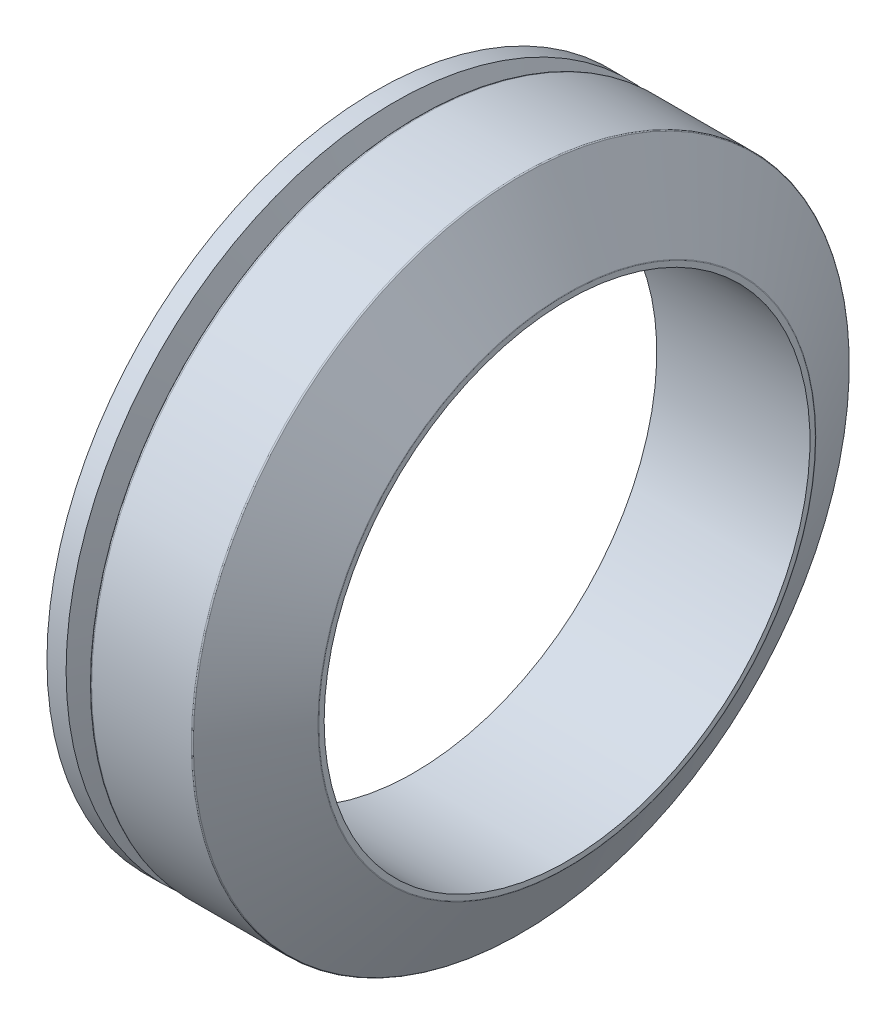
SolidWorks part; units mm, degrees
ref_plane "Plan1" through (0, 0, 0) normal (0, 0, 1) x (1, 0, 0)
ref_plane "Plan2" through (0, 0, 0) normal (0, 1, 0) x (1, 0, 0)
ref_plane "Plan3" through (0, 0, 0) normal (1, 0, 0) x (0, 0, -1)
sketch "Esquisse1" plane through (0, 0, 0) normal (0, 0, 1) x (1, 0, 0)
  line L0 (0, 0) -> (6.7, 0) construction
  line L1 (1.34, 8.5) -> (6.7, 8.5)
  line L2 (6.7, 8.5) -> (6.7, 8.6866)
  line L3 (5.0546, 11.5) -> (1.5644, 11.5)
  line L4 (1.216, 10) -> (1.4659, 11.4174)
  line L5 (1.216, 10) -> (0.67, 11.5)
  line L6 (8.5, 0) -> (-8.5, 0) construction
  line L7 (11.5, 0) -> (-11.5, 0) construction
  line L8 (0, 11.5) -> (1.34, 8.5)
  line L9 (0, 11.5) -> (0.67, 11.5)
  line L10 (5.0979, 11.475) -> (6.6933, 8.7116)
  line L16 (0, 0) -> (0, 11.5) construction
  line L17 (0, 11.5) -> (0.5, 11.5) construction
  arc A0 (1.4659, 11.4174) -> (1.5644, 11.5) centre (1.5644, 11.4) cw
  arc A1 (5.0979, 11.475) -> (5.0546, 11.5) centre (5.0546, 11.45) ccw
  arc A2 (6.7, 8.6866) -> (6.6933, 8.7116) centre (6.65, 8.6866) ccw
  point P17 (6.7, 8.7)
  dimension "D1" = 0.67
  dimension "D2" = 0.2
  dimension "D3" = 20
  dimension "D8" = 120
  dimension "D6" = 30
  dimension "D7" = 0.1
  dimension "D9" = 0.05
  dimension "Rint" = 8.5
  dimension "Rext" = 11.5
  dimension "D4" = 1.5
  dimension "Epaisseur" = 6.7
  dimension "D5" = 1.34
  dimension "Diamètre nominal" = 17
  dimension "Diamètre extérieur" = 23
  dimension "Hauteur C" = 3
revolve "Base-Révolution" add sketch "Esquisse1" angle 360 about L0
equation "\"Rext@Esquisse1\" = \"Diamètre extérieur@Esquisse1\"/2"
equation "\"Rint@Esquisse1\" = \"Diamètre nominal@Esquisse1\"/2"
equation "\"D5@Esquisse1\" = \"Epaisseur@Esquisse1\"/5"
equation "\"D4@Esquisse1\" = \"Hauteur C@Esquisse1\"/2"
equation "\"D1@Esquisse1\" = \"D5@Esquisse1\"/2"
